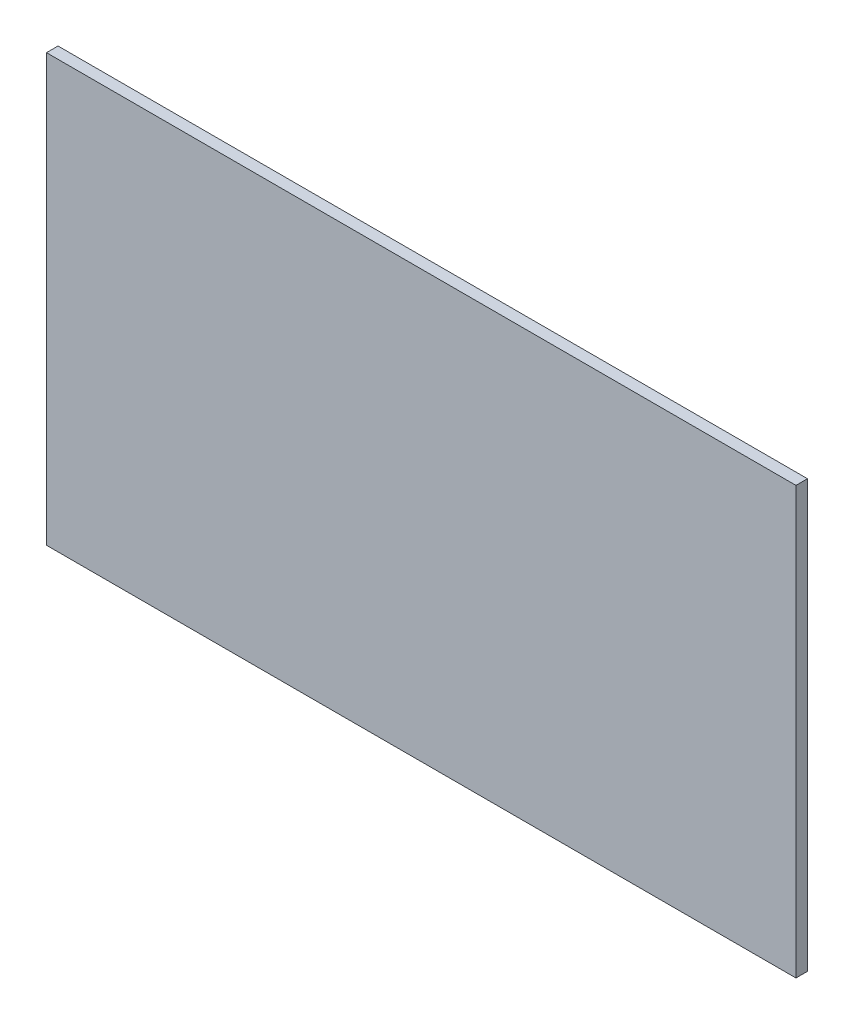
SolidWorks part; units mm, degrees
ref_plane "Front Plane" through (0, 0, 0) normal (0, 0, 1) x (1, 0, 0)
ref_plane "Top Plane" through (0, 0, 0) normal (0, 1, 0) x (1, 0, 0)
ref_plane "Right Plane" through (0, 0, 0) normal (1, 0, 0) x (0, 0, -1)
sketch "Sketch1" plane through (0, 0, 0) normal (0, 0, 1) x (1, 0, 0)
  line L1 (-412.75, -234.95) -> (412.75, -234.95)
  line L2 (-412.75, -234.95) -> (-412.75, 234.95)
  line L3 (-412.75, 234.95) -> (412.75, 234.95)
  line L4 (412.75, -234.95) -> (412.75, 234.95)
  line L5 (-412.75, -234.95) -> (412.75, 234.95) construction
  line L6 (-412.75, 234.95) -> (412.75, -234.95) construction
  point P0 (0, 0)
  dimension "D1" = 825.5
  dimension "D2" = 469.9
extrude "Extrude1" add sketch "Sketch1" along normal mid plane 12.7
